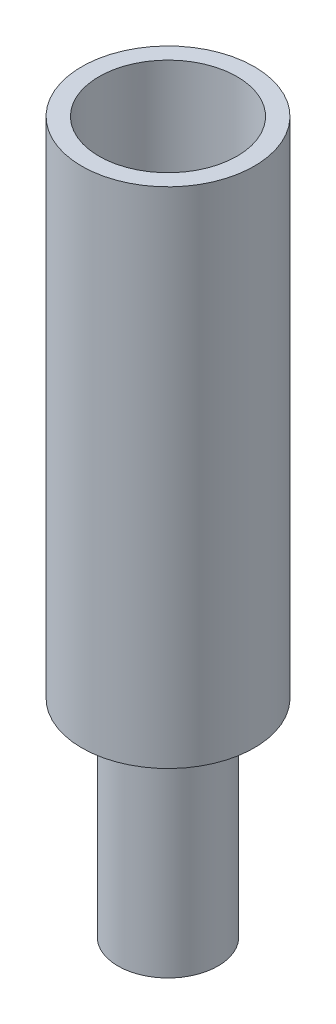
SolidWorks part; units mm, degrees
ref_plane "Front Plane" through (0, 0, 0) normal (0, 0, 1) x (1, 0, 0)
ref_plane "Top Plane" through (0, 0, 0) normal (0, 1, 0) x (1, 0, 0)
ref_plane "Right Plane" through (0, 0, 0) normal (1, 0, 0) x (0, 0, -1)
sketch "Sketch1" plane through (0, 0, 0) normal (0, 1, 0) x (1, 0, 0)
  circle A0 centre (0, 0) radius 7.25
extrude "Boss-Extrude1" add sketch "Sketch1" along normal blind 30
sketch "Sketch2" plane through (0, 30, 0) normal (0, 1, 0) x (1, 0, 0)
  circle A0 centre (0, 0) radius 12.5
extrude "Boss-Extrude2" add sketch "Sketch2" along normal blind 3
sketch "Sketch3" plane through (0, 33, 0) normal (0, 1, 0) x (1, 0, 0)
  circle A0 centre (0, 0) radius 12.5
extrude "Extrude-Thin1" add sketch "Sketch3" along normal blind 70 thin
